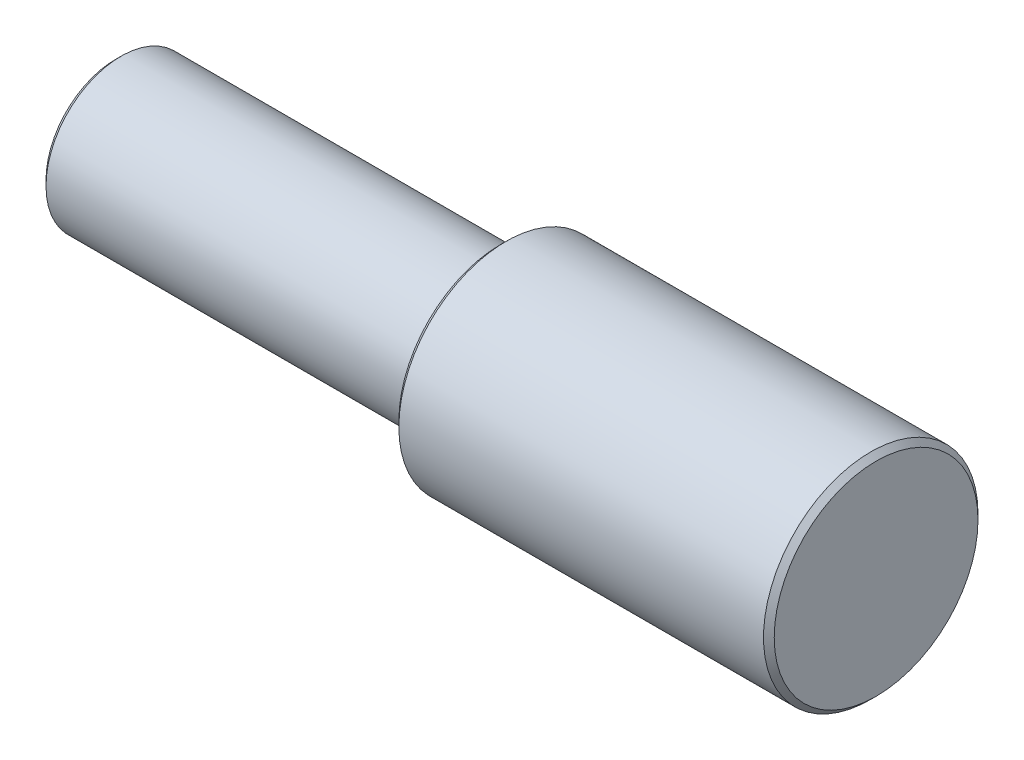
SolidWorks part; units mm, degrees
ref_plane "Front Plane" through (0, 0, 0) normal (0, 0, 1) x (1, 0, 0)
ref_plane "Top Plane" through (0, 0, 0) normal (0, 1, 0) x (1, 0, 0)
ref_plane "Right Plane" through (0, 0, 0) normal (1, 0, 0) x (0, 0, -1)
sketch "Sketch1" plane through (0, 0, 0) normal (0, 0, 1) x (1, 0, 0)
  line L0 (-35, 10) -> (-35, 0)
  line L1 (-35, 0) -> (0, 0)
  line L2 (0, 0) -> (0, 10)
  line L3 (0, 10) -> (-35, 10)
  line L4 (-35, 0) -> (0, 0) construction
  dimension "D1" = 35
  dimension "D2" = 10
revolve "Revolve1" add sketch "Sketch1" angle 360 about L4
sketch "Sketch2" plane through (-35, 0, 0) normal (-1, 0, 0) x (0, 0, 1)
  circle A0 centre (0, 0) radius 7
  dimension "D1" = 14
extrude "Boss-Extrude1" add sketch "Sketch2" along normal blind 35.9
ref_plane "Plane1" through (0, 0, -4) normal (0, 0, 1) x (1, 0, 0)
sketch "Sketch3" plane through (0, 0, -4) normal (0, 0, 1) x (1, 0, 0)
  line L0 (-40.45, 2.5) -> (-65.45, 2.5)
  line L1 (-65.45, -2.5) -> (-40.45, -2.5)
  arc A0 (-65.45, 2.5) -> (-65.45, -2.5) centre (-65.45, 0) ccw
  arc A1 (-40.45, -2.5) -> (-40.45, 2.5) centre (-40.45, 0) ccw
  dimension "D1" = 2.5
  dimension "D2" = 25
hole_wizard "M6x1.0 Tapped Hole1" positions "Sketch5" profile "Sketch4" tap size "M6x1.0" standard "ANSI Metric"
sketch "Sketch5" plane through (-70.9, 0, 0) normal (-1, 0, 0) x (0, 0, 1)
  point P0 (0, 0)
sketch "Sketch4" plane through (-70.9, 0, 0) normal (0, 1, 0) x (0, 0, 1)
  line L0 (0, 0) -> (0, 26.5022)
  line L1 (0, 26.5022) -> (2.5, 25)
  line L2 (2.5, 25) -> (2.5, 0)
  line L5 (2.5, 0) -> (0, 0)
  line L10 (0, 26.5022) -> (-2.5, 25) construction
  line L11 (0, -6.35) -> (0, 107.95) construction
  dimension "Tap Drill Dia." = 5
  dimension "Tap Drill Depth" = 25
  dimension "Drill Angle" = 118
chamfer "Chamfer1" distance 0.5 angle 45 4 edges at (0, 0, -10) (-35, 0, -10) (-70.9, 0, 2.5) (-70.9, 0, 7)
extrude "Cut-Extrude2" cut sketch "Sketch3" against normal blind 10
